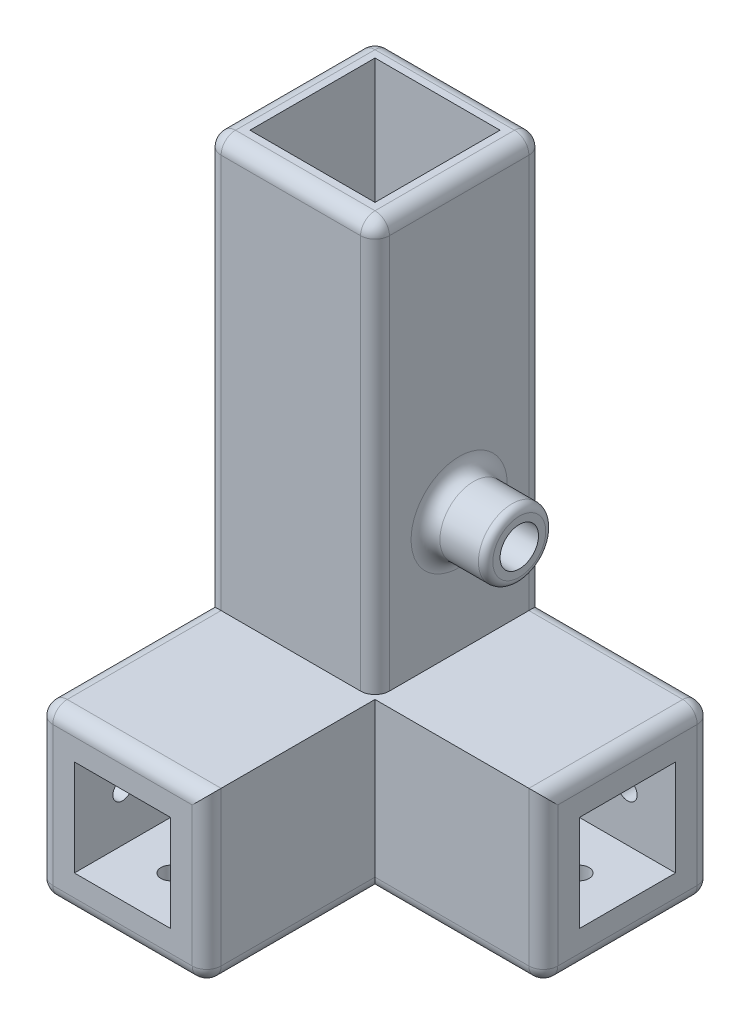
SolidWorks part; units mm, degrees
ref_plane "Alzado" through (0, 0, 0) normal (0, 0, 1) x (1, 0, 0)
ref_plane "Planta" through (0, 0, 0) normal (0, 1, 0) x (1, 0, 0)
ref_plane "Vista lateral" through (0, 0, 0) normal (1, 0, 0) x (0, 0, -1)
sketch "Sketch1" plane through (0, 0, 0) normal (0, 0, 1) x (1, 0, 0)
  line L0 (0, 70) -> (0, 0)
  line L1 (0, 0) -> (70, 0)
  line L2 (70, 0) -> (70, 35)
  line L3 (70, 35) -> (35, 35)
  line L4 (35, 35) -> (35, 70)
  line L5 (35, 70) -> (0, 70)
  dimension "D1" = 70
  dimension "D2" = 70
  dimension "D3" = 35
  dimension "D4" = 35
extrude "Boss-Extrude1" add sketch "Sketch1" along normal blind 35
sketch "Sketch2" plane through (0, 0, 35) normal (0, 0, 1) x (1, 0, 0)
  line L0 (35, 35) -> (0, 35)
  line L1 (0, 70) -> (0, 0) construction
  line L2 (0, 35) -> (0, 0)
  line L3 (0, 0) -> (35, 0)
  line L4 (0, 0) -> (70, 0) construction
  line L5 (35, 0) -> (35, 35)
extrude "Boss-Extrude2" add sketch "Sketch2" along normal blind 35
sketch "Sketch3" plane through (0, 0, 70) normal (0, 0, 1) x (1, 0, 0)
  line L0 (35, 0) -> (35, 35) construction
  line L1 (7.5, 27.5) -> (27.5, 27.5)
  line L2 (7.5, 27.5) -> (7.5, 7.5)
  line L3 (7.5, 7.5) -> (27.5, 7.5)
  line L4 (27.5, 27.5) -> (27.5, 7.5)
  line L5 (7.5, 27.5) -> (27.5, 7.5) construction
  line L6 (7.5, 7.5) -> (27.5, 27.5) construction
  line L7 (0, 0) -> (35, 0) construction
  point P0 (17.5, 17.5)
  dimension "D1" = 17.5
  dimension "D2" = 17.5
  dimension "D3" = 20
  dimension "D4" = 20
sketch "Sketch4" plane through (70, 0, 0) normal (1, 0, 0) x (0, 0, -1)
  line L0 (0, 0) -> (0, 35) construction
  line L1 (-27.5, 27.5) -> (-7.5, 27.5)
  line L2 (-27.5, 27.5) -> (-27.5, 7.5)
  line L3 (-27.5, 7.5) -> (-7.5, 7.5)
  line L4 (-7.5, 27.5) -> (-7.5, 7.5)
  line L5 (-27.5, 27.5) -> (-7.5, 7.5) construction
  line L6 (-27.5, 7.5) -> (-7.5, 27.5) construction
  line L7 (-35, 0) -> (0, 0) construction
  point P0 (-17.5, 17.5)
  dimension "D1" = 20
  dimension "D2" = 20
  dimension "D3" = 17.5
  dimension "D4" = 17.5
extrude "Cut-Extrude1" cut sketch "Sketch3" against normal blind 20 contours L3 L4 L1 L2
extrude "Cut-Extrude2" cut sketch "Sketch4" against normal blind 20 contours L3 L4 L1 L2
fillet "Fillet1" radius 3 14 edges at (35, 0, 0) (70, 17.5, 0) (52.5, 35, 0) (17.5, 35, 70) (0, 0, 35) (0, 17.5, 70) (0, 35, 52.5) (70, 35, 17.5) (70, 17.5, 35) (35, 17.5, 70) (70, 0, 17.5) (52.5, 0, 35) (35, 0, 52.5) (17.5, 0, 70)
sketch "Sketch7" plane through (0, 0, 0) normal (-1, 0, 0) x (0, 0, 1)
  line L1 (67, 0) -> (3, 0) construction
  line L2 (70, 32) -> (70, 3) construction
  circle A0 centre (60, 17.5) radius 2
  dimension "D2" = 4
  dimension "D3" = 17.5
  dimension "D4" = 10
extrude "Cut-Extrude4" cut sketch "Sketch7" against normal blind 10
sketch "Sketch8" plane through (0, 0, 0) normal (0, 0, -1) x (-1, 0, 0)
  line L0 (-70, 3) -> (-70, 32) construction
  line L1 (-67, 35) -> (-35, 35) construction
  circle A0 centre (-60, 17.5) radius 2
  dimension "D1" = 4
  dimension "D2" = 10
  dimension "D3" = 17.5
extrude "Cut-Extrude5" cut sketch "Sketch8" against normal blind 10
sketch "Sketch9" plane through (0, 70, 0) normal (0, 1, 0) x (1, 0, 0)
  line L1 (0, 0) -> (35, 0)
  line L2 (0, 0) -> (0, -35)
  line L3 (0, -35) -> (35, -35)
  line L4 (35, 0) -> (35, -35)
extrude "Boss-Extrude3" add sketch "Sketch9" along normal blind 50
sketch "Sketch10" plane through (0, 120, 0) normal (0, 1, 0) x (1, 0, 0)
  line L0 (35, 0) -> (0, 0) construction
  line L1 (4.5, -4.5) -> (30.5, -4.5)
  line L2 (4.5, -4.5) -> (4.5, -30.5)
  line L3 (4.5, -30.5) -> (30.5, -30.5)
  line L4 (30.5, -4.5) -> (30.5, -30.5)
  line L5 (4.5, -4.5) -> (30.5, -30.5) construction
  line L6 (4.5, -30.5) -> (30.5, -4.5) construction
  line L7 (0, 0) -> (0, -35) construction
  point P0 (17.5, -17.5)
  dimension "D1" = 26
  dimension "D2" = 26
  dimension "D3" = 17.5
  dimension "D4" = 17.5
extrude "Cut-Extrude6" cut sketch "Sketch10" against normal blind 50
fillet "Fillet2" radius 3 11 edges at (0, 120, 17.5) (17.5, 120, 35) (35, 120, 17.5) (17.5, 120, 0) (35, 77.5, 35) (35, 76, 0) (35, 34.1213, 0.8787) (0.8787, 34.1213, 35) (0, 61.5, 0) (0, 76, 35) (0.8787, 0.8787, 0.8787)
sketch "Sketch11" plane through (0, 0, 0) normal (-1, 0, 0) x (0, 0, 1)
  line L0 (35, 117) -> (35, 35) construction
  line L1 (3, 120) -> (32, 120) construction
  circle A0 centre (17.5, 100) radius 2
  dimension "D1" = 4
  dimension "D2" = 17.5
  dimension "D3" = 20
extrude "Cut-Extrude7" cut sketch "Sketch11" against normal blind 20
sketch "Sketch12" plane through (0, 0, 0) normal (0, 0, -1) x (-1, 0, 0)
  line L0 (-32, 120) -> (-3, 120) construction
  line L1 (0, 117) -> (0, 3) construction
  circle A0 centre (-17.5, 100) radius 2
  dimension "D1" = 4
  dimension "D2" = 20
  dimension "D3" = 17.5
extrude "Cut-Extrude8" cut sketch "Sketch12" against normal blind 20
sketch "Sketch13" plane through (0, 0, 0) normal (0, -1, 0) x (1, 0, 0)
  line L0 (67, 0) -> (3, 0) construction
  line L1 (70, 32) -> (70, 3) construction
  line L3 (35, 67) -> (35, 35) construction
  line L4 (3, 70) -> (32, 70) construction
  circle A0 centre (17.5, 60) radius 2
  circle A1 centre (60, 17.5) radius 2
  point P12 (17.1412, 61.9251)
  dimension "D1" = 4
  dimension "D2" = 4
  dimension "D3" = 17.5
  dimension "D4" = 10
  dimension "D5" = 17.5
  dimension "D6" = 10
extrude "Cut-Extrude9" cut sketch "Sketch13" against normal blind 20
sketch "Sketch16" plane through (35, 0, 0) normal (1, 0, 0) x (0, 0, -1)
  line L0 (-32, 120) -> (-3, 120) construction
  line L1 (0, 117) -> (0, 32) construction
  circle A0 centre (-17.5, 60) radius 7
  dimension "D1" = 14
  dimension "D2" = 60
  dimension "D3" = 17.5
extrude "Boss-Extrude5" add sketch "Sketch16" along normal blind 12.5
fillet "Fillet5" radius 3 1 edges at (35, 60, 24.5)
sketch "Sketch17" plane through (47.5, 0, 0) normal (1, 0, 0) x (0, 0, -1)
  circle A0 centre (-17.5, 60) radius 4
  dimension "D1" = 8
extrude "Cut-Extrude11" cut sketch "Sketch17" against normal blind 30
fillet "Fillet6" radius 1.5 1 edges at (47.5, 60, 10.5)
